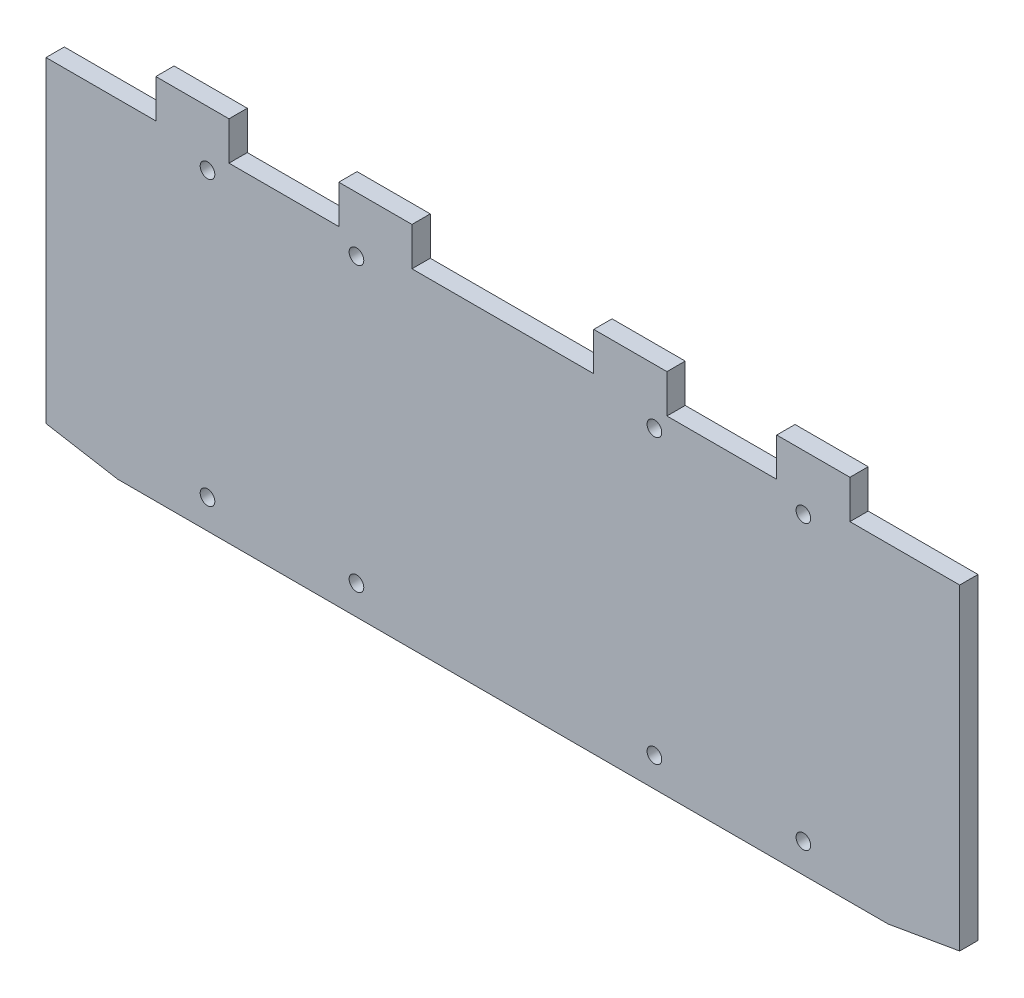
SolidWorks part; units mm, degrees
ref_plane "Front Plane" through (0, 0, 0) normal (0, 0, 1) x (1, 0, 0)
ref_plane "Top Plane" through (0, 0, 0) normal (0, 1, 0) x (1, 0, 0)
ref_plane "Right Plane" through (0, 0, 0) normal (1, 0, 0) x (0, 0, -1)
sketch "Sketch1" plane through (0, 0, 0) normal (0, 0, 1) x (1, 0, 0)
  line L0 (1.27, -53.7326) -> (-11.1577, -55.88)
  line L1 (-11.1577, -55.88) -> (-144.8423, -55.88)
  line L2 (-144.8423, -55.88) -> (-157.27, -53.7326)
  line L3 (-157.27, -53.7326) -> (-157.27, 1.27)
  line L4 (-157.27, 1.27) -> (-138.22, 1.27)
  line L5 (-157.27, 1.27) -> (1.27, 1.27) construction
  line L6 (-138.22, 1.27) -> (-138.22, 7.9375)
  line L7 (-152.19, 7.9375) -> (-3.81, 7.9375) construction
  line L8 (-138.22, 7.9375) -> (-125.52, 7.9375)
  line L9 (-125.52, 7.9375) -> (-125.52, 1.27)
  line L10 (-78, -55.88) -> (-78, 22.9207) construction
  line L11 (-125.52, 1.27) -> (-106.47, 1.27)
  line L12 (-106.47, 1.27) -> (-106.47, 7.9375)
  line L13 (-106.47, 7.9375) -> (-93.77, 7.9375)
  line L14 (-93.77, 7.9375) -> (-93.77, 1.27)
  line L15 (-93.77, 1.27) -> (-62.23, 1.27)
  line L16 (-62.23, 7.9375) -> (-62.23, 1.27)
  line L17 (-49.53, 7.9375) -> (-62.23, 7.9375)
  line L18 (-49.53, 1.27) -> (-49.53, 7.9375)
  line L19 (-30.48, 1.27) -> (-49.53, 1.27)
  line L20 (-30.48, 7.9375) -> (-30.48, 1.27)
  line L21 (-17.78, 7.9375) -> (-30.48, 7.9375)
  line L22 (-17.78, 1.27) -> (-17.78, 7.9375)
  line L23 (1.27, 1.27) -> (-17.78, 1.27)
  line L24 (1.27, 1.27) -> (1.27, -53.7326)
  circle A0 centre (-129.25, -1.6626) radius 1.27
  circle A1 centre (-103.4, -1.6626) radius 1.27
  circle A2 centre (-129.25, -50.8) radius 1.27
  circle A3 centre (-103.4, -50.8) radius 1.27
  circle A4 centre (-51.7, -50.8) radius 1.27
  circle A5 centre (-25.85, -50.8) radius 1.27
  circle A6 centre (-51.7, -1.6626) radius 1.27
  circle A7 centre (-25.85, -1.6626) radius 1.27
  circle A8 centre (-129.25, -1.6626) radius 1.27 construction
  circle A9 centre (-129.25, -50.8) radius 1.27 construction
  point P33 (-78, 1.27)
  dimension "D1" = 12.7
  dimension "D2" = 19.05
  dimension "D3" = 12.7
  dimension "D4" = 19.05
extrude "Boss-Extrude1" add sketch "Sketch1" along normal blind 3.175
